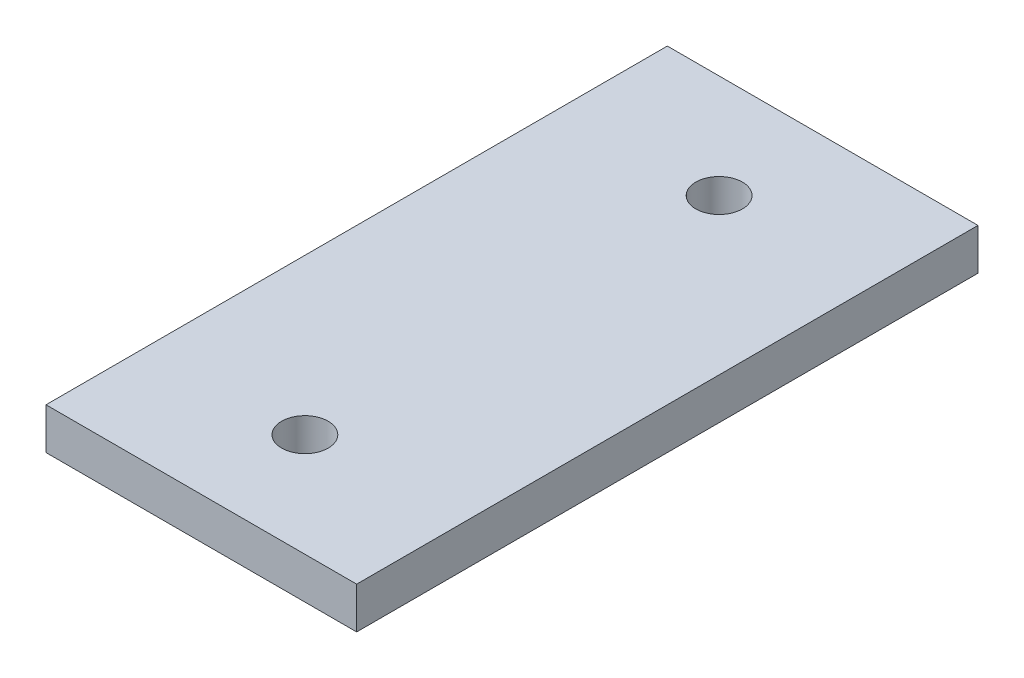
SolidWorks part; units mm, degrees
ref_plane "Face" through (0, 0, 0) normal (0, 0, 1) x (1, 0, 0)
ref_plane "Dessus" through (0, 0, 0) normal (0, 1, 0) x (1, 0, 0)
ref_plane "Droite" through (0, 0, 0) normal (1, 0, 0) x (0, 0, -1)
sketch "Esquisse1" plane through (0, 0, 0) normal (0, 0, 1) x (1, 0, 0)
  line L1 (0, 0) -> (60, 0)
  line L2 (0, 0) -> (0, -8)
  line L3 (0, -8) -> (60, -8)
  line L4 (60, 0) -> (60, -8)
  dimension "D1" = 60
  dimension "D2" = 8
extrude "Base-Extrusion" add sketch "Esquisse1" along normal blind 120
sketch "Esquisse2" plane through (0, 0, 0) normal (0, 1, 0) x (-1, 0, 0)
  line L0 (-60, 0) -> (0, 0) construction
  line L1 (-60, 120) -> (-60, 0) construction
  circle A0 centre (-30, 100) radius 4.5
  circle A1 centre (-30, 20) radius 4.5
  dimension "D2" = 9
  dimension "D1" = 80
  dimension "D3" = 20
  dimension "D4" = 30
extrude "Enlèv. mat.-Extru.1" cut sketch "Esquisse2" against normal blind 10
